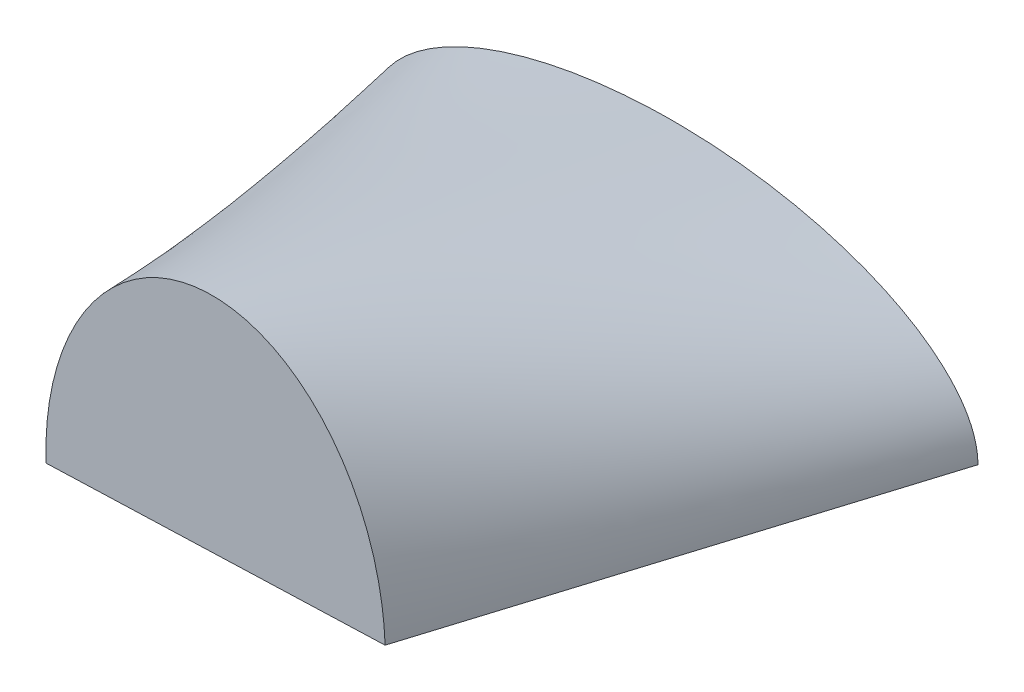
SolidWorks part; units mm, degrees
ref_plane "Ebene vorne" through (0, 0, 0) normal (0, 0, 1) x (1, 0, 0)
ref_plane "Ebene oben" through (0, 0, 0) normal (0, 1, 0) x (1, 0, 0)
ref_plane "Ebene rechts" through (0, 0, 0) normal (1, 0, 0) x (0, 0, -1)
ref_plane "Ebene1" through (0, 0, 95) normal (0, 0, 1) x (1, 0, 0)
sketch "Skizze1" plane through (0, 0, 0) normal (0, 0, 1) x (1, 0, 0)
  line L0 (-62.9135, 0) -> (62.9135, 0) construction
  ellipse E0 centre (0, 0) end of major axis (-62.9135, 0) minor radius 30.1006 (62.9135, 0) -> (-62.9135, 0) ccw
sketch "Skizze2" plane through (0, 0, 95) normal (0, 0, 1) x (1, 0, 0)
  line L0 (-35.1103, -1.227) -> (35.1103, 1.227) construction
  ellipse E0 centre (0, 0) end of major axis (1.6097, -46.0609) minor radius 35.1317 (35.1103, 1.227) -> (-35.1103, -1.227) ccw
surface "Oberfläche-Ausformung1"
other "Begrenzung-Oberfläche1"
other "Begrenzung-Oberfläche2"
surface "Oberflächenausfüllung1"
surface "Oberfläche-Zusammenfügen1"
equation "\"LÄNGE\"=0"
equation "\"BREITE\"=0"
equation "\"HÖHE\"=0"
equation "\"DURCHMESSER\"=0"
equation "\"Stückzahl\"= 1"
